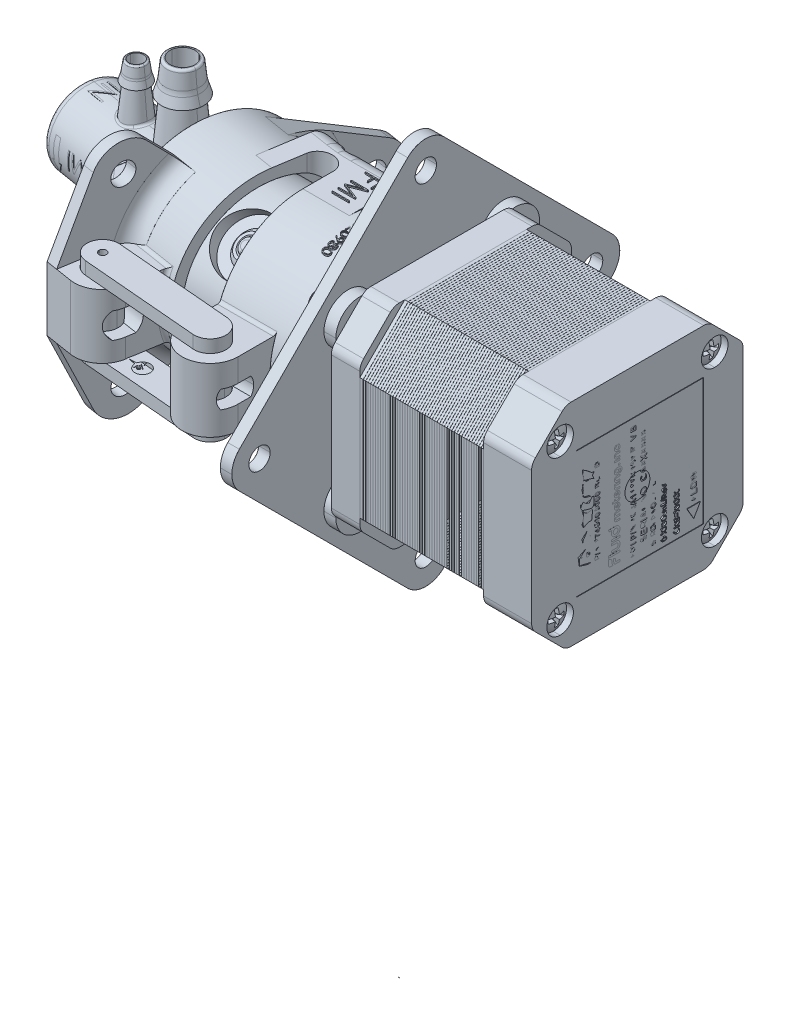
SolidWorks part; units mm, degrees
ref_plane "Front" through (0, 0, 0) normal (0, 0, 1) x (1, 0, 0)
ref_plane "Top" through (0, 0, 0) normal (0, 1, 0) x (1, 0, 0)
ref_plane "Right" through (0, 0, 0) normal (1, 0, 0) x (0, 0, -1)
imported_body "Surface-Imported1"
imported_body "Surface-Imported2"
imported_body "Surface-Imported3"
imported_body "Surface-Imported4"
imported_body "Surface-Imported5"
imported_body "Surface-Imported6"
imported_body "Surface-Imported7"
imported_body "Surface-Imported8"
imported_body "Surface-Imported9"
imported_body "Surface-Imported10"
imported_body "Surface-Imported11"
imported_body "Surface-Imported12"
imported_body "Surface-Imported13"
imported_body "Surface-Imported14"
imported_body "Surface-Imported15"
imported_body "Surface-Imported16"
imported_body "Surface-Imported17"
imported_body "Surface-Imported18"
imported_body "Surface-Imported19"
imported_body "Surface-Imported20"
imported_body "Surface-Imported21"
imported_body "Surface-Imported22"
imported_body "Surface-Imported23"
imported_body "Surface-Imported24"
imported_body "Surface-Imported25"
imported_body "Surface-Imported26"
imported_body "Surface-Imported27"
imported_body "Surface-Imported28"
imported_body "Surface-Imported29"
imported_body "Surface-Imported30"
imported_body "Surface-Imported31"
imported_body "Surface-Imported32"
imported_body "Surface-Imported33"
imported_body "Surface-Imported34"
imported_body "Surface-Imported35"
imported_body "Surface-Imported36"
imported_body "Surface-Imported37"
imported_body "Surface-Imported38"
imported_body "Surface-Imported39"
imported_body "Surface-Imported40"
imported_body "Surface-Imported41"
imported_body "Surface-Imported42"
imported_body "Surface-Imported43"
imported_body "Surface-Imported44"
imported_body "Surface-Imported45"
imported_body "Surface-Imported46"
imported_body "Surface-Imported47"
imported_body "Surface-Imported48"
imported_body "Surface-Imported49"
imported_body "Surface-Imported50"
imported_body "Surface-Imported51"
imported_body "Surface-Imported52"
imported_body "Surface-Imported53"
imported_body "Surface-Imported54"
imported_body "Surface-Imported55"
imported_body "Surface-Imported56"
imported_body "Surface-Imported57"
imported_body "Surface-Imported58"
imported_body "Surface-Imported59"
imported_body "Surface-Imported60"
imported_body "Surface-Imported61"
imported_body "Surface-Imported62"
imported_body "Surface-Imported63"
imported_body "Surface-Imported64"
imported_body "Surface-Imported65"
imported_body "Surface-Imported66"
imported_body "Surface-Imported67"
imported_body "Surface-Imported68"
imported_body "Surface-Imported69"
imported_body "Surface-Imported70"
imported_body "Surface-Imported71"
imported_body "Surface-Imported72"
imported_body "Surface-Imported73"
imported_body "Surface-Imported74"
imported_body "Surface-Imported75"
imported_body "Surface-Imported76"
imported_body "Surface-Imported77"
imported_body "Surface-Imported78"
imported_body "Surface-Imported79"
imported_body "Surface-Imported80"
imported_body "Surface-Imported81"
imported_body "Surface-Imported82"
imported_body "Surface-Imported83"
imported_body "Surface-Imported84"
imported_body "Surface-Imported85"
imported_body "Surface-Imported86"
imported_body "Surface-Imported87"
imported_body "Surface-Imported88"
imported_body "Surface-Imported89"
imported_body "Surface-Imported90"
imported_body "Surface-Imported91"
imported_body "Surface-Imported92"
imported_body "Surface-Imported93"
imported_body "Surface-Imported94"
imported_body "Surface-Imported95"
imported_body "Surface-Imported96"
imported_body "Surface-Imported97"
imported_body "Surface-Imported98"
imported_body "Surface-Imported99"
imported_body "Surface-Imported100"
imported_body "Surface-Imported101"
imported_body "Surface-Imported102"
imported_body "Surface-Imported103"
imported_body "Surface-Imported104"
imported_body "Surface-Imported105"
imported_body "Surface-Imported106"
imported_body "Surface-Imported107"
imported_body "Surface-Imported108"
imported_body "Surface-Imported109"
imported_body "Surface-Imported110"
imported_body "Surface-Imported111"
imported_body "Surface-Imported112"
imported_body "Surface-Imported113"
imported_body "Surface-Imported114"
imported_body "Surface-Imported115"
imported_body "Surface-Imported116"
imported_body "Surface-Imported117"
imported_body "Surface-Imported118"
imported_body "Surface-Imported119"
imported_body "Surface-Imported120"
imported_body "Surface-Imported121"
imported_body "Surface-Imported122"
imported_body "Surface-Imported123"
imported_body "Surface-Imported124"
imported_body "Surface-Imported125"
imported_body "Surface-Imported126"
imported_body "Surface-Imported127"
imported_body "Surface-Imported128"
imported_body "Surface-Imported129"
imported_body "Surface-Imported130"
imported_body "Surface-Imported131"
imported_body "Surface-Imported132"
imported_body "Surface-Imported133"
imported_body "Surface-Imported134"
imported_body "Surface-Imported135"
imported_body "Surface-Imported136"
imported_body "Surface-Imported137"
imported_body "Surface-Imported138"
imported_body "Surface-Imported139"
imported_body "Surface-Imported140"
imported_body "Surface-Imported141"
imported_body "Surface-Imported142"
imported_body "Surface-Imported143"
imported_body "Surface-Imported144"
imported_body "Surface-Imported145"
imported_body "Surface-Imported146"
imported_body "Surface-Imported147"
imported_body "Surface-Imported148"
imported_body "Surface-Imported149"
imported_body "Surface-Imported150"
imported_body "Surface-Imported151"
imported_body "Surface-Imported152"
imported_body "Surface-Imported153"
imported_body "Surface-Imported154"
imported_body "Surface-Imported155"
imported_body "Surface-Imported156"
imported_body "Surface-Imported157"
imported_body "Surface-Imported158"
imported_body "Surface-Imported159"
imported_body "Surface-Imported160"
imported_body "Surface-Imported161"
imported_body "Surface-Imported162"
imported_body "Surface-Imported163"
imported_body "Surface-Imported164"
imported_body "Surface-Imported165"
imported_body "Surface-Imported166"
imported_body "Surface-Imported167"
imported_body "Surface-Imported168"
imported_body "Surface-Imported169"
imported_body "Surface-Imported170"
imported_body "Surface-Imported171"
imported_body "Surface-Imported172"
imported_body "Surface-Imported173"
imported_body "Surface-Imported174"
imported_body "Surface-Imported175"
imported_body "Surface-Imported176"
imported_body "Surface-Imported177"
imported_body "Surface-Imported178"
imported_body "Surface-Imported179"
imported_body "Surface-Imported180"
imported_body "Surface-Imported181"
imported_body "Surface-Imported182"
imported_body "Surface-Imported183"
imported_body "Surface-Imported184"
imported_body "Surface-Imported185"
imported_body "Surface-Imported186"
imported_body "Surface-Imported187"
imported_body "Surface-Imported188"
imported_body "Surface-Imported189"
imported_body "Surface-Imported190"
imported_body "Surface-Imported191"
imported_body "Surface-Imported192"
imported_body "Surface-Imported193"
imported_body "Surface-Imported194"
imported_body "Surface-Imported195"
imported_body "Surface-Imported196"
imported_body "Surface-Imported197"
imported_body "Surface-Imported198"
imported_body "Surface-Imported199"
imported_body "Surface-Imported200"
imported_body "Surface-Imported201"
imported_body "Surface-Imported202"
imported_body "Surface-Imported203"
imported_body "Surface-Imported204"
imported_body "Surface-Imported205"
imported_body "Surface-Imported206"
imported_body "Surface-Imported207"
imported_body "Surface-Imported208"
imported_body "Surface-Imported209"
imported_body "Surface-Imported210"
imported_body "Surface-Imported211"
imported_body "Surface-Imported212"
imported_body "Surface-Imported213"
imported_body "Surface-Imported214"
imported_body "Surface-Imported215"
imported_body "Surface-Imported216"
imported_body "Surface-Imported217"
imported_body "Surface-Imported218"
imported_body "Surface-Imported219"
imported_body "Surface-Imported220"
imported_body "Surface-Imported221"
imported_body "Surface-Imported222"
imported_body "Surface-Imported223"
imported_body "Surface-Imported224"
imported_body "Surface-Imported225"
imported_body "Surface-Imported226"
imported_body "Surface-Imported227"
imported_body "Surface-Imported228"
imported_body "Surface-Imported229"
imported_body "Surface-Imported230"
imported_body "Surface-Imported231"
imported_body "Surface-Imported232"
imported_body "Surface-Imported233"
imported_body "Surface-Imported234"
imported_body "Surface-Imported235"
imported_body "Surface-Imported236"
imported_body "Surface-Imported237"
imported_body "Surface-Imported238"
imported_body "Surface-Imported239"
imported_body "Surface-Imported240"
imported_body "Surface-Imported241"
imported_body "Surface-Imported242"
imported_body "Surface-Imported243"
imported_body "Surface-Imported244"
imported_body "Surface-Imported245"
imported_body "Surface-Imported246"
imported_body "Surface-Imported247"
imported_body "Surface-Imported248"
imported_body "Surface-Imported249"
imported_body "Surface-Imported250"
imported_body "Surface-Imported251"
imported_body "Surface-Imported252"
imported_body "Surface-Imported253"
imported_body "Surface-Imported254"
imported_body "Surface-Imported255"
imported_body "Surface-Imported256"
imported_body "Surface-Imported257"
imported_body "Surface-Imported258"
imported_body "Surface-Imported259"
imported_body "Surface-Imported260"
imported_body "Surface-Imported261"
imported_body "Surface-Imported262"
imported_body "Surface-Imported263"
imported_body "Surface-Imported264"
imported_body "Surface-Imported265"
imported_body "Surface-Imported266"
imported_body "Surface-Imported267"
imported_body "Surface-Imported268"
imported_body "Surface-Imported269"
imported_body "Surface-Imported270"
imported_body "Surface-Imported271"
imported_body "Surface-Imported272"
imported_body "Surface-Imported273"
imported_body "Surface-Imported274"
imported_body "Surface-Imported275"
imported_body "Surface-Imported276"
imported_body "Surface-Imported277"
imported_body "Surface-Imported278"
imported_body "Surface-Imported279"
imported_body "Surface-Imported280"
imported_body "Surface-Imported281"
imported_body "Surface-Imported282"
imported_body "Surface-Imported283"
imported_body "Surface-Imported284"
imported_body "Surface-Imported285"
imported_body "Surface-Imported286"
imported_body "Surface-Imported287"
imported_body "Surface-Imported288"
imported_body "Surface-Imported289"
imported_body "Surface-Imported290"
imported_body "Surface-Imported291"
imported_body "Surface-Imported292"
imported_body "Surface-Imported293"
imported_body "Surface-Imported294"
imported_body "Surface-Imported295"
imported_body "Surface-Imported296"
imported_body "Surface-Imported297"
imported_body "Surface-Imported298"
imported_body "Surface-Imported299"
imported_body "Surface-Imported300"
imported_body "Surface-Imported301"
imported_body "Surface-Imported302"
imported_body "Surface-Imported303"
imported_body "Surface-Imported304"
imported_body "Surface-Imported305"
imported_body "Surface-Imported306"
imported_body "Surface-Imported307"
imported_body "Surface-Imported308"
imported_body "Surface-Imported309"
imported_body "Surface-Imported310"
imported_body "Surface-Imported311"
imported_body "Surface-Imported312"
imported_body "Surface-Imported313"
imported_body "Surface-Imported314"
imported_body "Surface-Imported315"
imported_body "Surface-Imported316"
imported_body "Surface-Imported317"
imported_body "Surface-Imported318"
imported_body "Surface-Imported319"
imported_body "Surface-Imported320"
imported_body "Surface-Imported321"
imported_body "Surface-Imported322"
imported_body "Surface-Imported323"
imported_body "Surface-Imported324"
imported_body "Surface-Imported325"
imported_body "Surface-Imported326"
imported_body "Surface-Imported327"
imported_body "Surface-Imported328"
imported_body "Surface-Imported329"
imported_body "Surface-Imported330"
imported_body "Surface-Imported331"
imported_body "Surface-Imported332"
imported_body "Surface-Imported333"
imported_body "Surface-Imported334"
imported_body "Surface-Imported335"
imported_body "Surface-Imported336"
imported_body "Surface-Imported337"
imported_body "Surface-Imported338"
imported_body "Surface-Imported339"
imported_body "Surface-Imported340"
imported_body "Surface-Imported341"
imported_body "Surface-Imported342"
imported_body "Surface-Imported343"
imported_body "Surface-Imported344"
imported_body "Surface-Imported345"
imported_body "Surface-Imported346"
imported_body "Surface-Imported347"
imported_body "Surface-Imported348"
imported_body "Surface-Imported349"
imported_body "Surface-Imported350"
imported_body "Surface-Imported351"
imported_body "Surface-Imported352"
imported_body "Surface-Imported353"
imported_body "Surface-Imported354"
imported_body "Surface-Imported355"
imported_body "Surface-Imported356"
imported_body "Surface-Imported357"
imported_body "Surface-Imported358"
imported_body "Surface-Imported359"
imported_body "Surface-Imported360"
imported_body "Surface-Imported361"
imported_body "Surface-Imported362"
imported_body "Surface-Imported363"
imported_body "Surface-Imported364"
imported_body "Surface-Imported365"
imported_body "Surface-Imported366"
imported_body "Surface-Imported367"
imported_body "Surface-Imported368"
imported_body "Surface-Imported369"
imported_body "Surface-Imported370"
imported_body "Surface-Imported371"
imported_body "Surface-Imported372"
imported_body "Surface-Imported373"
imported_body "Surface-Imported374"
imported_body "Surface-Imported375"
imported_body "Surface-Imported376"
imported_body "Surface-Imported377"
imported_body "Surface-Imported378"
imported_body "Surface-Imported379"
imported_body "Surface-Imported380"
imported_body "Surface-Imported381"
imported_body "Surface-Imported382"
imported_body "Surface-Imported383"
imported_body "Surface-Imported384"
imported_body "Surface-Imported385"
imported_body "Surface-Imported386"
imported_body "Surface-Imported387"
imported_body "Surface-Imported388"
imported_body "Surface-Imported389"
imported_body "Surface-Imported390"
imported_body "Surface-Imported391"
imported_body "Surface-Imported392"
imported_body "Surface-Imported393"
imported_body "Surface-Imported394"
imported_body "Surface-Imported395"
imported_body "Surface-Imported396"
imported_body "Surface-Imported397"
imported_body "Surface-Imported398"
imported_body "Surface-Imported399"
imported_body "Surface-Imported400"
imported_body "Surface-Imported401"
imported_body "Surface-Imported402"
imported_body "Surface-Imported403"
imported_body "Surface-Imported404"
imported_body "Surface-Imported405"
imported_body "Surface-Imported406"
imported_body "Surface-Imported407"
imported_body "Surface-Imported408"
imported_body "Surface-Imported409"
imported_body "Surface-Imported410"
imported_body "Surface-Imported411"
imported_body "Surface-Imported412"
imported_body "Surface-Imported413"
imported_body "Surface-Imported414"
imported_body "Surface-Imported415"
imported_body "Surface-Imported416"
imported_body "Surface-Imported417"
imported_body "Surface-Imported418"
imported_body "Surface-Imported419"
imported_body "Surface-Imported420"
imported_body "Surface-Imported421"
imported_body "Surface-Imported422"
imported_body "Surface-Imported423"
imported_body "Surface-Imported424"
imported_body "Surface-Imported425"
imported_body "Surface-Imported426"
imported_body "Surface-Imported427"
imported_body "Surface-Imported428"
imported_body "Surface-Imported429"
imported_body "Surface-Imported430"
imported_body "Surface-Imported431"
imported_body "Surface-Imported432"
imported_body "Surface-Imported433"
imported_body "Surface-Imported434"
imported_body "Surface-Imported435"
imported_body "Surface-Imported436"
imported_body "Surface-Imported437"
imported_body "Surface-Imported438"
imported_body "Surface-Imported439"
imported_body "Surface-Imported440"
imported_body "Surface-Imported441"
imported_body "Surface-Imported442"
imported_body "Surface-Imported443"
imported_body "Surface-Imported444"
imported_body "Surface-Imported445"
imported_body "Surface-Imported446"
imported_body "Surface-Imported447"
imported_body "Surface-Imported448"
imported_body "Surface-Imported449"
imported_body "Surface-Imported450"
imported_body "Surface-Imported451"
imported_body "Surface-Imported452"
imported_body "Surface-Imported453"
imported_body "Surface-Imported454"
imported_body "Surface-Imported455"
imported_body "Surface-Imported456"
imported_body "Surface-Imported457"
imported_body "Surface-Imported458"
imported_body "Surface-Imported459"
imported_body "Surface-Imported460"
imported_body "Surface-Imported461"
imported_body "Surface-Imported462"
imported_body "Surface-Imported463"
imported_body "Surface-Imported464"
imported_body "Surface-Imported465"
imported_body "Surface-Imported466"
imported_body "Surface-Imported467"
imported_body "Surface-Imported468"
imported_body "Surface-Imported469"
imported_body "Surface-Imported470"
imported_body "Surface-Imported471"
imported_body "Surface-Imported472"
imported_body "Surface-Imported473"
imported_body "Surface-Imported474"
imported_body "Surface-Imported475"
imported_body "Surface-Imported476"
imported_body "Surface-Imported477"
imported_body "Surface-Imported478"
imported_body "Surface-Imported479"
imported_body "Surface-Imported480"
imported_body "Surface-Imported481"
imported_body "Surface-Imported482"
imported_body "Surface-Imported483"
imported_body "Surface-Imported484"
imported_body "Surface-Imported485"
imported_body "Surface-Imported486"
imported_body "Surface-Imported487"
imported_body "Surface-Imported488"
imported_body "Surface-Imported489"
imported_body "Surface-Imported490"
imported_body "Surface-Imported491"
imported_body "Surface-Imported492"
imported_body "Surface-Imported493"
imported_body "Surface-Imported494"
ref_plane "Plane1" through (0, -61.1176, 61.1176) normal (0, 0.7071, -0.7071) x (-1, 0, 0)
ref_plane "Plane2" through (0, 7.9187, 7.9187) normal (0, -0.7071, -0.7071) x (-1, 0, 0)
delete or keep bodies "Body-Delete/Keep 1" type delete bodies bodies 209 104 120 210 583 212 121 587 147 240 580 213
